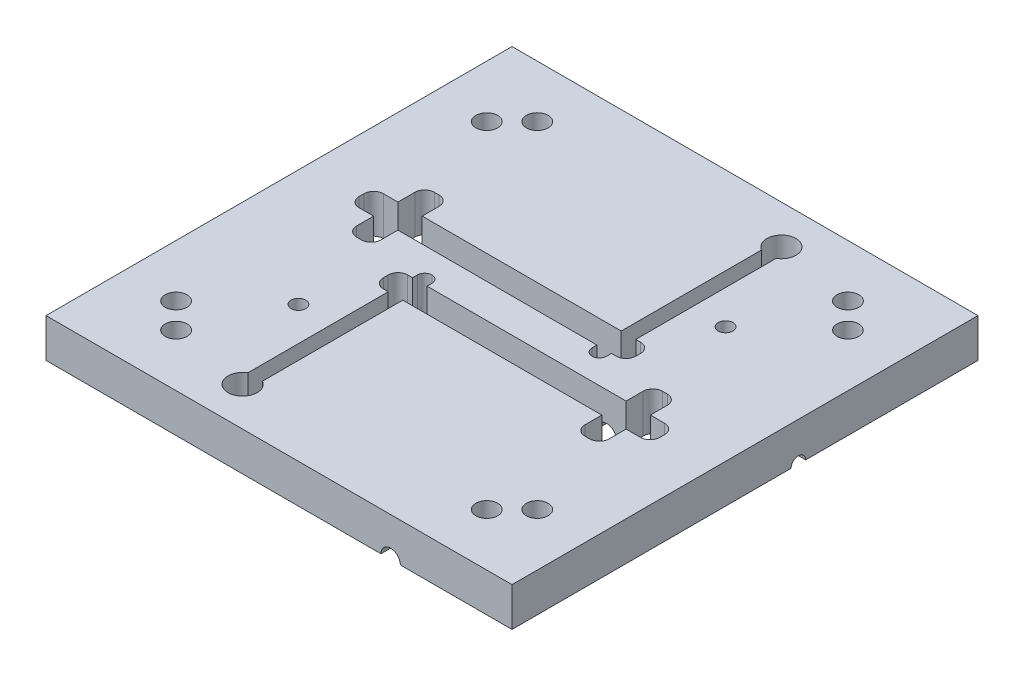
SolidWorks part; units mm, degrees
ref_plane "Front" through (0, 0, 0) normal (0, 0, 1) x (1, 0, 0)
ref_plane "Top" through (0, 0, 0) normal (0, 1, 0) x (1, 0, 0)
ref_plane "Right" through (0, 0, 0) normal (1, 0, 0) x (0, 0, -1)
sketch "Sketch1" plane through (0, 0, 0) normal (0, 1, 0) x (1, 0, 0)
  line L1 (-152.4, -152.4) -> (152.4, -152.4)
  line L2 (-152.4, -152.4) -> (-152.4, 152.4)
  line L3 (-152.4, 152.4) -> (152.4, 152.4)
  line L4 (152.4, -152.4) -> (152.4, 152.4)
  dimension "D1" = 304.8
  dimension "D2" = 304.8
  dimension "D3" = 152.4
  dimension "D4" = 152.4
extrude "Extrude1" add sketch "Sketch1" along normal mid plane 25.4
sketch "Sketch2" plane through (0, 12.7, 0) normal (0, 1, 0) x (-1, 0, 0)
  line L1 (50, 0) -> (-50, 0) construction
  line L2 (0, 50) -> (0, -50) construction
  circle A0 centre (118.11, -101.6) radius 7.112
  circle A1 centre (-118.11, -101.6) radius 7.112
  circle A2 centre (101.6, -118.11) radius 7.1374
  circle A3 centre (-101.6, -118.11) radius 7.1374
  dimension "D1" = 14.224
  dimension "D5" = 14.2748
  dimension "D6" = 14.2748
  dimension "D7" = 118.11
  dimension "D8" = 101.6
  dimension "D9" = 101.6
  dimension "D10" = 118.11
  dimension "D2" = 101.6
  dimension "D3" = 118.11
  dimension "D4" = 118.11
extrude "Cut-Extrude1" cut sketch "Sketch2" against normal through all
mirror "Mirror1" about plane through (0, 0, 0) normal (0, 0, 1) of "Cut-Extrude1"
sketch "Sketch3" plane through (0, 12.7, 0) normal (0, 1, 0) x (-1, 0, 0)
  line L1 (101.6, -44.45) -> (85.725, -44.45)
  line L2 (101.6, -44.45) -> (101.6, 6.35)
  line L3 (101.6, 6.35) -> (85.725, 6.35)
  line L4 (85.725, -44.45) -> (85.725, 6.35)
  dimension "D1" = 50.8
  dimension "D2" = 15.875
  dimension "D3" = 101.6
  dimension "D4" = 44.45
extrude "Cut-Extrude2" cut sketch "Sketch3" against normal through all
fillet "Fillet1" radius 6.35 1 edges at (-101.6, 0, -44.45)
fillet "Fillet2" radius 6.35 1 edges at (-85.725, 0, -44.45)
fillet "Fillet3" radius 6.35 1 edges at (-101.6, 0, 6.35)
fillet "Fillet4" radius 6.35 1 edges at (-85.725, 0, 6.35)
ref_plane "Plane1" through (0, 12.7, 0) normal (0, 1, 0) x (-1, 0, 0)
sketch "Sketch5" plane through (0, 12.7, 0) normal (0, 1, 0) x (-1, 0, 0)
  line L1 (117.475, -11.0998) -> (-63.5, -11.0998)
  line L2 (117.475, -11.0998) -> (117.475, -26.9748)
  line L3 (117.475, -26.9748) -> (-63.5, -26.9748)
  line L4 (-63.5, -11.0998) -> (-63.5, -26.9748)
  dimension "D1" = 15.875
  dimension "D2" = 180.975
  dimension "D3" = 117.475
  dimension "D4" = 11.0998
extrude "Cut-Extrude4" cut sketch "Sketch5" against normal through all
fillet "Fillet5" radius 6.35 1 edges at (-117.475, 0, -26.9748)
fillet "Fillet6" radius 6.35 1 edges at (-117.475, 0, -11.0998)
fillet "Fillet7" radius 6.35 1 edges at (63.5, 0, -26.9748)
fillet "Fillet8" radius 6.35 1 edges at (63.5, 0, -11.0998)
sketch "Sketch7" plane through (152.4, 0, 0) normal (1, 0, 0) x (0, 0, -1)
  line L1 (-152.4, -12.7) -> (152.4, -12.7) construction
  circle A0 centre (34.925, -12.7) radius 4.7625
  dimension "D2" = 9.525
  dimension "D1" = 34.925
extrude "Cut-Extrude6" cut sketch "Sketch7" against normal blind 127
sketch "Sketch9" plane through (0, 12.7, 0) normal (0, 1, 0) x (-1, 0, 0)
  circle A0 centre (-49.1998, -127) radius 9.525
  dimension "D1" = 19.05
  dimension "D2" = 127
  dimension "D3" = 49.1998
extrude "Cut-Extrude10" cut sketch "Sketch9" against normal through all
sketch "Sketch12" plane through (0, 12.7, 0) normal (0, 1, 0) x (-1, 0, 0)
  line L1 (-85.725, -6.35) -> (-101.6, -6.35)
  line L2 (-85.725, -6.35) -> (-85.725, 44.45)
  line L3 (-85.725, 44.45) -> (-101.6, 44.45)
  line L4 (-101.6, -6.35) -> (-101.6, 44.45)
  dimension "D1" = 50.8
  dimension "D2" = 15.875
  dimension "D3" = 101.6
  dimension "D4" = 44.45
extrude "Cut-Extrude13" cut sketch "Sketch12" against normal through all
fillet "Fillet11" radius 6.35 1 edges at (85.725, 0, -6.35)
fillet "Fillet12" radius 6.35 1 edges at (101.6, 0, -6.35)
fillet "Fillet13" radius 6.35 1 edges at (101.6, 0, 44.45)
fillet "Fillet14" radius 6.35 1 edges at (85.725, 0, 44.45)
sketch "Sketch13" plane through (0, 12.7, 0) normal (0, 1, 0) x (-1, 0, 0)
  line L1 (-117.348, 26.9748) -> (-38.1, 26.9748)
  line L2 (-117.348, 26.9748) -> (-117.348, 11.0998)
  line L3 (-117.348, 11.0998) -> (-38.1, 11.0998)
  line L4 (-38.1, 26.9748) -> (-38.1, 11.0998)
  dimension "D1" = 15.875
  dimension "D2" = 11.0998
  dimension "D3" = 79.248
  dimension "D4" = 38.1
extrude "Cut-Extrude14" cut sketch "Sketch13" against normal through all
fillet "Fillet15" radius 6.35 1 edges at (117.348, 0, 11.0998)
fillet "Fillet16" radius 6.35 1 edges at (117.348, 0, 26.9748)
fillet "Fillet17" radius 6.35 1 edges at (38.1, 0, 26.9748)
fillet "Fillet18" radius 6.35 1 edges at (38.1, 0, 11.0998)
sketch "Sketch14" plane through (0, 12.7, 0) normal (0, 1, 0) x (-1, 0, 0)
  line L1 (63.5, 26.9748) -> (-51.2935, 26.9748)
  line L2 (63.5, 26.9748) -> (63.5, 11.0998)
  line L3 (63.5, 11.0998) -> (-51.2935, 11.0998)
  line L4 (-51.2935, 26.9748) -> (-51.2935, 11.0998)
  dimension "D1" = 15.875
  dimension "D2" = 63.5
  dimension "D3" = 11.0998
  dimension "D4" = 114.7935
extrude "Cut-Extrude15" cut sketch "Sketch14" against normal through all
fillet "Fillet19" radius 6.35 1 edges at (-63.5, 0, 11.0998)
fillet "Fillet20" radius 6.35 1 edges at (-63.5, 0, 26.9748)
sketch "Sketch17" plane through (0, 12.7, 0) normal (0, 1, 0) x (-1, 0, 0)
  circle A0 centre (49.1998, 127) radius 9.525
  dimension "D1" = 19.05
  dimension "D2" = 49.1998
  dimension "D3" = 127
extrude "Cut-Extrude18" cut sketch "Sketch17" against normal through all
sketch "Sketch18" plane through (0, 0, 152.4) normal (0, 0, 1) x (1, 0, 0)
  line L1 (-152.4, -12.7) -> (152.4, -12.7) construction
  circle A0 centre (73.025, -12.7) radius 6.35
  point P4 (0, -12.7)
  dimension "D1" = 12.7
  dimension "D2" = 73.025
extrude "Cut-Extrude19" cut sketch "Sketch18" against normal blind 177.8
sketch "Sketch19" plane through (0, 0, -152.4) normal (0, 0, -1) x (-1, 0, 0)
  line L1 (-152.4, -12.7) -> (152.4, -12.7) construction
  circle A0 centre (73.025, -12.7) radius 6.35
  point P4 (0, -12.7)
  dimension "D1" = 12.7
  dimension "D2" = 73.025
extrude "Cut-Extrude20" cut sketch "Sketch19" against normal blind 177.8
sketch "Sketch21" plane through (-152.4, 0, 0) normal (-1, 0, 0) x (0, 0, 1)
  line L1 (-152.4, -12.7) -> (152.4, -12.7) construction
  circle A0 centre (34.925, -12.7) radius 4.7625
  dimension "D1" = 9.525
  dimension "D2" = 34.925
extrude "Cut-Extrude22" cut sketch "Sketch21" against normal blind 127
sketch "Sketch23" plane through (0, 12.7, 0) normal (0, 1, 0) x (-1, 0, 0)
  line L1 (53.975, 130.175) -> (44.45, 130.175)
  line L2 (53.975, 130.175) -> (53.975, 3.175)
  line L3 (53.975, 3.175) -> (44.45, 3.175)
  line L4 (44.45, 130.175) -> (44.45, 3.175)
  dimension "D1" = 9.525
  dimension "D2" = 44.45
  dimension "D3" = 3.175
  dimension "D4" = 127
extrude "Cut-Extrude23" cut sketch "Sketch23" against normal through all
fillet "Fillet21" radius 4.7498 1 edges at (-53.975, 0, 3.175)
fillet "Fillet22" radius 4.7498 1 edges at (-44.45, 0, 3.175)
sketch "Sketch24" plane through (0, 12.7, 0) normal (0, 1, 0) x (-1, 0, 0)
  line L1 (-44.45, -130.175) -> (-53.975, -130.175)
  line L2 (-44.45, -130.175) -> (-44.45, -3.175)
  line L3 (-44.45, -3.175) -> (-53.975, -3.175)
  line L4 (-53.975, -130.175) -> (-53.975, -3.175)
  dimension "D1" = 3.175
  dimension "D2" = 127
  dimension "D3" = 9.525
  dimension "D4" = 44.45
extrude "Cut-Extrude24" cut sketch "Sketch24" against normal through all
fillet "Fillet23" radius 4.7498 1 edges at (44.45, 0, -3.175)
fillet "Fillet24" radius 4.7498 1 edges at (53.975, 0, -3.175)
sketch "Sketch26" plane through (0, -12.7, 0) normal (0, -1, 0) x (1, 0, 0)
  circle A0 centre (76.2, -63.5) radius 4.826
  circle A1 centre (-76.2, 63.5) radius 4.826
  dimension "D1" = 9.652
  dimension "D4" = 9.652
  dimension "D2" = 76.2
  dimension "D3" = 63.5
  dimension "D5" = 76.2
  dimension "D6" = 63.5
extrude "Cut-Extrude25" cut sketch "Sketch26" against normal through all
